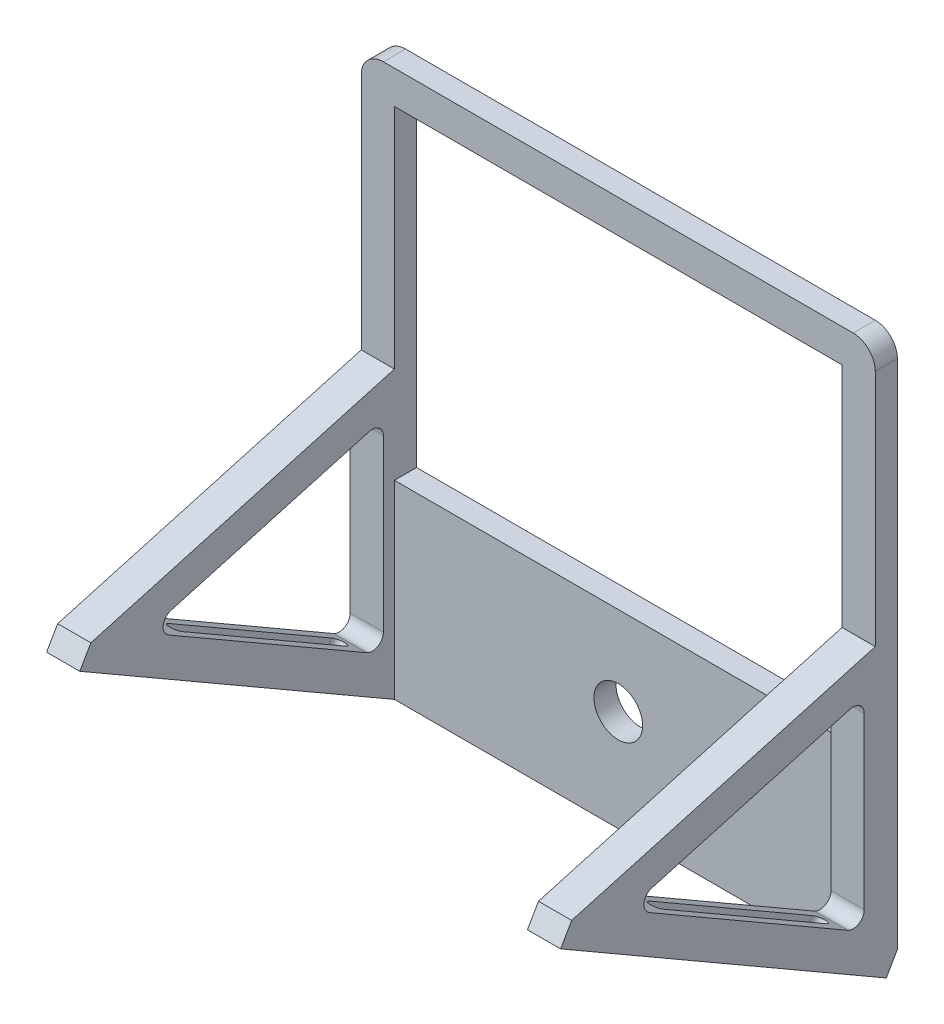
SolidWorks part; units mm, degrees
ref_plane "Ebene vorne" through (0, 0, 0) normal (0, 0, 1) x (1, 0, 0)
ref_plane "Ebene oben" through (0, 0, 0) normal (0, 1, 0) x (1, 0, 0)
ref_plane "Ebene rechts" through (0, 0, 0) normal (1, 0, 0) x (0, 0, -1)
sketch "Skizze1" plane through (0, 0, 0) normal (0, 0, 1) x (1, 0, 0)
  line L0 (-116.166, 88.166) -> (116.166, 88.166)
  line L1 (-101.166, 73.166) -> (101.166, 73.166)
  line L2 (-101.166, 73.166) -> (-101.166, -73.166)
  line L3 (-101.166, -73.166) -> (101.166, -73.166)
  line L4 (101.166, 73.166) -> (101.166, -73.166)
  line L5 (-116.166, 88.166) -> (-116.166, -153.166)
  line L6 (116.166, 88.166) -> (116.166, -153.166)
  line L7 (-116.166, -153.166) -> (116.166, -153.166)
  arc A0 (-93.6, 76.3) -> (-104.3, 65.6) centre (-93.6, 65.6) ccw construction
  arc A1 (93.6, -76.3) -> (104.3, -65.6) centre (93.6, -65.6) ccw construction
  dimension "D1" = 202.3321
  dimension "D2" = 146.3321
  dimension "D3" = 15
  dimension "D4" = 15
  dimension "D5" = 80
  dimension "D6" = 15
extrude "Aufsatz-Linear austragen1" add sketch "Skizze1" along normal blind 10
sketch "Skizze2" plane through (116.166, 0, 0) normal (1, 0, 0) x (0, 0, -1)
  line L0 (0, -153.166) -> (-147.2243, -68.166)
  line L1 (0, -153.166) -> (-5, -161.8263)
  line L2 (-147.2243, -68.166) -> (-152.2243, -76.8263)
  line L3 (-5, -161.8263) -> (-152.2243, -76.8263)
  line L4 (0, -153.166) -> (0, 88.166) construction
  dimension "D1" = 10
  dimension "D2" = 120
  dimension "D3" = 170
extrude "Aufsatz-Linear austragen2" add sketch "Skizze2" against normal up to surface (232.3321 mm away)
sketch "Skizze3" plane through (116.166, 0, 0) normal (1, 0, 0) x (0, 0, -1)
  line L0 (-147.2243, -68.166) -> (-10, -147.3925)
  line L1 (-10, -147.3925) -> (-147.2243, -68.166) construction
  line L2 (-10, -147.3925) -> (-10, -29.6132)
  line L3 (-10, -147.3925) -> (-10, 88.166) construction
  line L4 (-10, -29.6132) -> (-147.2243, -68.166)
  line L5 (-112.0668, -82.6907) -> (-22.5, -134.4022)
  line L6 (-15, -130.072) -> (-15, -53.197)
  line L7 (-21.3524, -48.3834) -> (-110.9192, -73.547)
  line L8 (0, -153.166) -> (0, 88.166) construction
  line L9 (-152.2243, -76.8263) -> (-5, -161.8263) construction
  arc A0 (-15, -130.072) -> (-22.5, -134.4022) centre (-20, -130.072) cw
  arc A1 (-112.0668, -82.6907) -> (-110.9192, -73.547) centre (-109.5668, -78.3606) cw
  arc A2 (-15, -53.197) -> (-21.3524, -48.3834) centre (-20, -53.197) ccw
  point P21 (-159.7477, -95.0226)
  dimension "D4" = 5
  dimension "D5" = 5
  dimension "D1" = 15
  dimension "D2" = 15
  dimension "D3" = 15
extrude "Aufsatz-Linear austragen3" add sketch "Skizze3" against normal up to surface (232.3321 mm away)
sketch "Skizze4" plane through (0, 88.166, 0) normal (0, 1, 0) x (1, 0, 0)
  line L4 (-101.166, -10) -> (101.166, -10)
  line L5 (-101.166, -10) -> (-101.166, -191.8266)
  line L6 (101.166, -10) -> (101.166, -191.8266)
  line L7 (-101.166, -191.8266) -> (101.166, -191.8266)
  line L8 (116.166, -10) -> (-116.166, -10) construction
  line L9 (-116.166, -147.2243) -> (-116.166, -10) construction
  line L10 (116.166, -10) -> (116.166, -147.2243) construction
  dimension "D1" = 15
  dimension "D2" = 15
extrude "Schnitt-Linear austragen1" cut sketch "Skizze4" against normal through all
fillet "Verrundung1" radius 10 2 edges at (116.166, 88.166, 5) (-116.166, 88.166, 5)
sketch "Skizze5" plane through (0, 0, 0) normal (0, 0, -1) x (-1, 0, 0)
  line L0 (-101.166, -73.166) -> (-101.166, -153.166) construction
  line L1 (116.166, -153.166) -> (-116.166, -153.166) construction
  line L2 (101.166, -73.166) -> (101.166, -153.166) construction
  line L3 (-101.166, -113.166) -> (101.166, -113.166) construction
  circle A0 centre (0, -113.166) radius 11
  point P12 (0, -113.166)
  dimension "D1" = 22
extrude "Schnitt-Linear austragen2" cut sketch "Skizze5" against normal up to next
sketch "Skizze8" plane through (0, -123.5348, 71.3228) normal (0, -0.866, 0.5) x (1, 0, 0)
  line L0 (-108.666, 43.417) -> (-108.666, -41.583) construction
  line L1 (-105.466, 43.417) -> (-105.466, -41.583)
  line L2 (-111.866, 43.417) -> (-111.866, -41.583)
  line L3 (-101.166, 93.417) -> (-101.166, -70.8095) construction
  line L4 (-116.166, 93.417) -> (-101.166, 93.417) construction
  line L5 (-116.166, -76.583) -> (116.166, -76.583) construction
  line L6 (0, 0) -> (0, 93.9782) construction
  line L7 (108.666, 43.417) -> (108.666, -41.583) construction
  line L8 (105.466, 43.417) -> (105.466, -41.583)
  line L9 (111.866, 43.417) -> (111.866, -41.583)
  arc A0 (-105.466, 43.417) -> (-111.866, 43.417) centre (-108.666, 43.417) ccw
  arc A1 (-111.866, -41.583) -> (-105.466, -41.583) centre (-108.666, -41.583) ccw
  arc A2 (105.466, 43.417) -> (111.866, 43.417) centre (108.666, 43.417) cw
  arc A3 (111.866, -41.583) -> (105.466, -41.583) centre (108.666, -41.583) cw
  point P2 (-108.666, 0.917)
  point P18 (108.666, 0.917)
  dimension "D1" = 6.4
  dimension "D2" = 7.5
  dimension "D3" = 50
  dimension "D4" = 35
extrude "Schnitt-Linear austragen3" cut sketch "Skizze8" against normal up to next
